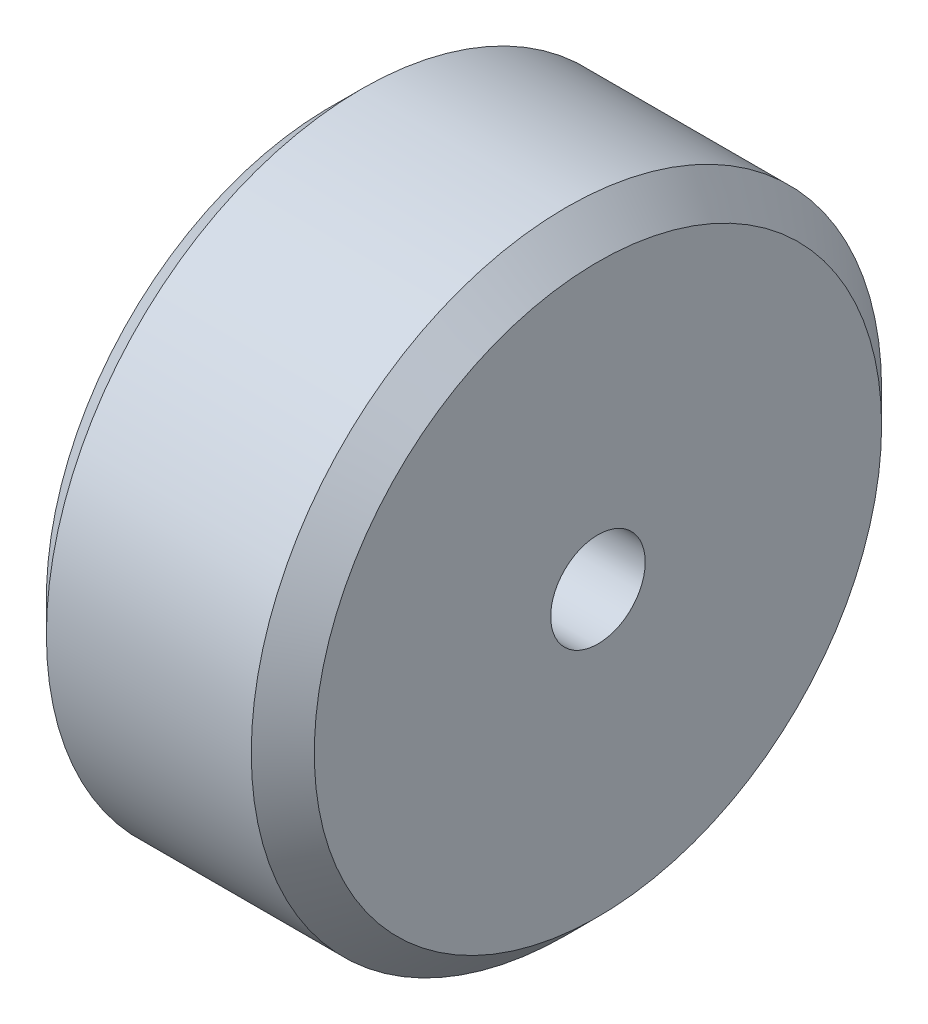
SolidWorks part; units mm, degrees
ref_plane "Front Plane" through (0, 0, 0) normal (0, 0, 1) x (1, 0, 0)
ref_plane "Top Plane" through (0, 0, 0) normal (0, 1, 0) x (1, 0, 0)
ref_plane "Right Plane" through (0, 0, 0) normal (1, 0, 0) x (0, 0, -1)
sketch "Sketch1" plane through (0, 0, 0) normal (1, 0, 0) x (0, 0, -1)
  circle A0 centre (0, 0) radius 12.7
  dimension "D1" = 25.4
extrude "Boss-Extrude1" add sketch "Sketch1" along normal blind 10.795
sketch "Sketch2" plane through (10.795, 0, 0) normal (1, 0, 0) x (0, 0, -1)
  circle A0 centre (0, 0) radius 1.905
  dimension "D1" = 3.81
extrude "Cut-Extrude1" cut sketch "Sketch2" against normal blind 10.795
chamfer "Chamfer1" distance 1.27 angle 45 2 edges at (0, 0, -12.7) (10.795, 0, -12.7)
